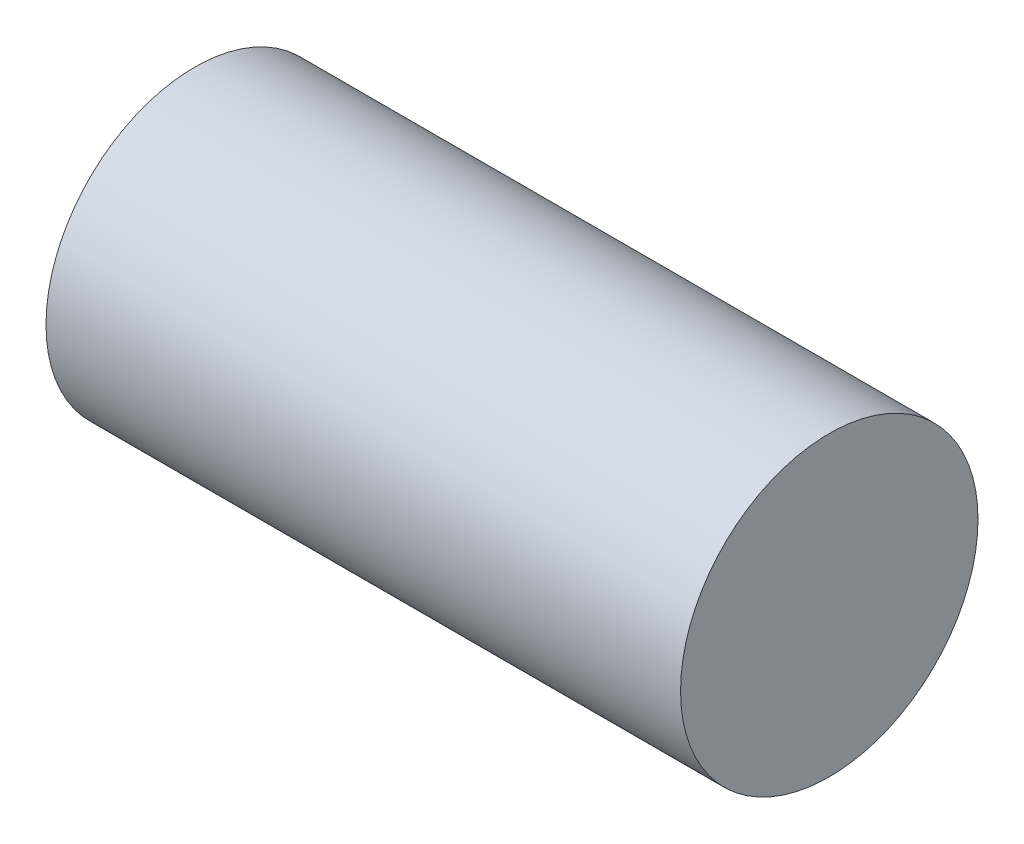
SolidWorks part; units mm, degrees
ref_plane "Front Plane" through (0, 0, 0) normal (0, 0, 1) x (1, 0, 0)
ref_plane "Top Plane" through (0, 0, 0) normal (0, 1, 0) x (1, 0, 0)
ref_plane "Right Plane" through (0, 0, 0) normal (1, 0, 0) x (0, 0, -1)
sketch "Sketch1" plane through (0, 0, 0) normal (1, 0, 0) x (0, 0, -1)
  circle A0 centre (0, 0) radius 4.7625
  dimension "D1" = 9.525
extrude "Boss-Extrude1" add sketch "Sketch1" along normal blind 20.32
